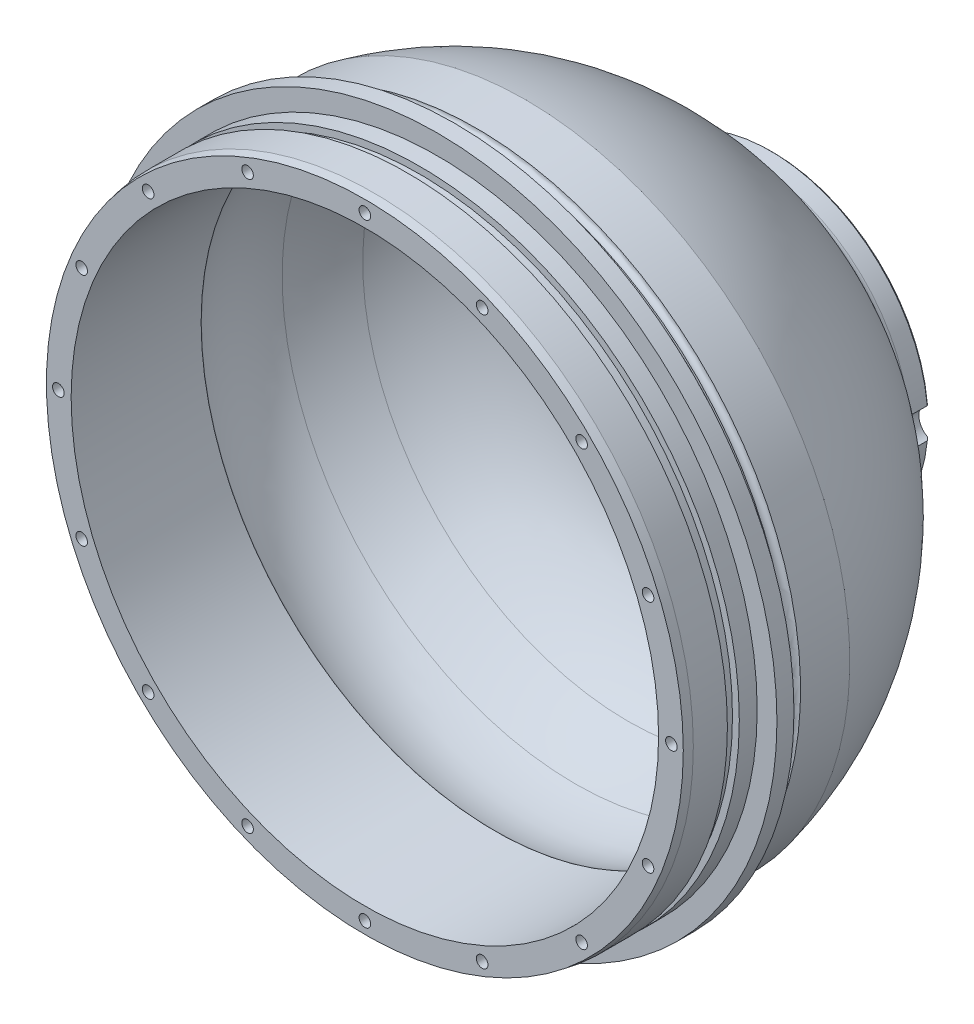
SolidWorks part; units mm, degrees
ref_plane "Front Plane" through (0, 0, 0) normal (0, 0, 1) x (1, 0, 0)
ref_plane "Top Plane" through (0, 0, 0) normal (0, 1, 0) x (1, 0, 0)
ref_plane "Right Plane" through (0, 0, 0) normal (1, 0, 0) x (0, 0, -1)
sketch "Sketch1" plane through (0, 0, 0) normal (1, 0, 0) x (0, 0, -1)
  line L0 (0, 0) -> (0, -87.63) construction
  line L1 (0, -87.63) -> (0, -101.346)
  line L2 (0, -87.63) -> (26.67, -87.63)
  line L3 (0, 0) -> (164.6305, 0) construction
  line L4 (0, -101.346) -> (26.67, -101.346)
  line L5 (26.67, -101.346) -> (26.67, -98.298)
  line L6 (26.67, -98.298) -> (38.7801, -98.298) construction
  line L7 (26.67, -87.63) -> (38.7801, -87.63)
  line L8 (121.7669, 0) -> (121.7669, -46.99)
  line L9 (121.7669, 0) -> (101.4469, 0)
  line L10 (26.67, -87.63) -> (49.53, -91.9045) construction
  line L11 (101.4469, 0) -> (101.4469, -57.9788)
  line L12 (121.7669, -46.99) -> (113.7225, -46.99)
  line L13 (38.7801, -87.63) -> (49.53, -91.9045)
  line L14 (26.67, -98.298) -> (26.67, -96.7105)
  line L15 (26.67, -96.7105) -> (47.9636, -96.7105)
  arc A1 (49.53, -91.9045) -> (101.4469, -57.9788) centre (26.5169, 0) ccw
  arc A2 (47.9636, -96.7105) -> (113.7225, -46.99) centre (26.5169, 0) ccw
  dimension "D6" = 99.06
  dimension "D7" = 94.742
  dimension "D1" = 87.63
  dimension "D2" = 101.346
  dimension "D3" = 26.67
  dimension "D4" = 26.67
  dimension "D5" = 3.048
  dimension "D8" = 46.99
  dimension "D9" = 20.32
  dimension "D10" = 22.86
  dimension "D11" = 12.1101
  dimension "D12" = 95.0969
revolve "hemi" add sketch "Sketch1" angle 360 about L3
sketch "Sketch2" plane through (0, 0, 0) normal (0, 0, 1) x (1, 0, 0)
  circle A0 centre (0, 0) radius 95.4532
  dimension "D1" = 190.9064
extrude "oring_plug" cut sketch "Sketch2" against normal blind 21.59 flip side to cut
ref_plane "oring_plane" through (0, 0, -12.7) normal (0, 0, 1) x (1, 0, 0)
sketch "Sketch3" plane through (0, 0, -12.7) normal (0, 0, 1) x (1, 0, 0)
  circle A0 centre (0, 0) radius 93.4212
  dimension "D1" = 186.8424
extrude "oring_groove" cut sketch "Sketch3" against normal blind 3.556 flip side to cut
chamfer "lead_in_chamfer" distance 2.54 distance2 0.4572 1 edges at (95.4532, 0, 0)
fillet "inside_blkhd_fillet" radius 50.8 1 edges at (57.9788, 0, -101.4469)
fillet "inside_flange_fillet" radius 31.75 1 edges at (91.9045, 0, -49.53)
ref_plane "ortman_plane" through (0, 0, -29.972) normal (0, 0, -1) x (-1, 0, 0)
sketch "Sketch4" plane through (0, 0, -29.972) normal (0, 0, -1) x (-1, 0, 0)
  circle A0 centre (0, 0) radius 95.0595
  dimension "D1" = 190.119
extrude "ortman_groove" cut sketch "Sketch4" along normal blind 3.302 flip side to cut
fillet "ortman_fillet" radius 1.651 2 edges at (-95.0595, 0, -29.972) (-95.0595, 0, -33.274)
sketch "Sketch5" plane through (0, 0, 0) normal (0, 0, 1) x (1, 0, 0)
  circle A0 centre (0, 0) radius 91.44 construction
  circle A1 centre (0, 91.44) radius 1.7272
  circle A2 centre (34.9926, 84.4795) radius 1.7272
  circle A3 centre (64.6578, 64.6578) radius 1.7272
  circle A4 centre (84.4795, 34.9926) radius 1.7272
  circle A5 centre (91.44, 0) radius 1.7272
  circle A6 centre (84.4795, -34.9926) radius 1.7272
  circle A7 centre (64.6578, -64.6578) radius 1.7272
  circle A8 centre (34.9926, -84.4795) radius 1.7272
  circle A9 centre (0, -91.44) radius 1.7272
  circle A10 centre (-34.9926, -84.4795) radius 1.7272
  circle A11 centre (-64.6578, -64.6578) radius 1.7272
  circle A12 centre (-84.4795, -34.9926) radius 1.7272
  circle A13 centre (-91.44, 0) radius 1.7272
  circle A14 centre (-84.4795, 34.9926) radius 1.7272
  circle A15 centre (-64.6578, 64.6578) radius 1.7272
  circle A16 centre (-34.9926, 84.4795) radius 1.7272
  dimension "D1" = 182.88
  dimension "D2" = 3.4544
extrude "male_bolt_circle_holes" cut sketch "Sketch5" against normal blind 7.62
sketch "blkhd_holes" plane through (0, 0, -121.7669) normal (0, 0, -1) x (-1, 0, 0)
  line L0 (0, 0) -> (0, 29.2621) construction
  line L1 (0, 0) -> (29.21, 0) construction
  circle A0 centre (0, 0) radius 4.953
  circle A1 centre (0, 0) radius 10.16 construction
  circle A2 centre (29.21, 16.002) radius 2.7051
  circle A3 centre (29.21, 16.002) radius 7.9375 construction
  circle A4 centre (-29.21, 16.002) radius 7.9375 construction
  circle A5 centre (-29.21, 16.002) radius 2.7051
  circle A6 centre (29.21, -16.002) radius 2.7051
  circle A7 centre (29.21, -16.002) radius 7.9375 construction
  circle A8 centre (-22.86, -5.08) radius 3.4544
  circle A9 centre (-22.86, -5.08) radius 9.525 construction
  circle A10 centre (8.89, -27.94) radius 5.7531
  circle A11 centre (8.89, -27.94) radius 13.335 construction
  circle A12 centre (12.7, 27.94) radius 11.43 construction
  circle A13 centre (12.7, 27.94) radius 5.7531
  circle A14 centre (-17.9617, -27.94) radius 11.43 construction
  dimension "D1" = 9.906
  dimension "D2" = 20.32
  dimension "D3" = 5.4102
  dimension "D6" = 15.875
  dimension "D7" = 6.9088
  dimension "D10" = 19.05
  dimension "D11" = 11.5062
  dimension "D12" = 26.67
  dimension "D15" = 11.5062
  dimension "D17" = 12.7
  dimension "D18" = 22.86
  dimension "D4" = 16.002
  dimension "D5" = 29.21
  dimension "D8" = 5.08
  dimension "D9" = 22.86
  dimension "D13" = 27.94
  dimension "D14" = 8.89
  dimension "D16" = 27.94
fillet "aft_land_fillet" radius 3.175 1 edges at (46.99, 0, -113.7225)
chamfer "Chamfer2" distance 0.762 angle 45 1 edges at (46.99, 0, -121.7669)
extrude "blkhd_thru_holes" cut sketch "blkhd_holes" against normal through all
sketch "Sketch7" plane through (0, 0, -121.7669) normal (0, 0, -1) x (-1, 0, 0)
  circle A0 centre (-10.16, 22) radius 6.35
  dimension "D1" = 12.7
  dimension "D2" = 10.16
  dimension "D3" = 22
sketch "Sketch8" plane through (0, 0, -121.7669) normal (0, 0, -1) x (-1, 0, 0)
  circle A0 centre (12.7, 27.94) radius 11.43
  circle A1 centre (29.21, 16.002) radius 7.9375
  circle A2 centre (29.21, -16.002) radius 7.9375
  circle A3 centre (8.89, -27.94) radius 13.335
  circle A4 centre (-22.86, -5.08) radius 9.525
  circle A5 centre (-29.21, 16.002) radius 7.9375
  circle A6 centre (0, 0) radius 10.16
  dimension "D1" = 22.86
  dimension "D2" = 15.875
  dimension "D3" = 19.05
  dimension "D4" = 26.67
  dimension "D5" = 15.875
  dimension "D6" = 15.875
  dimension "D7" = 20.32
extrude "lands" cut sketch "Sketch8" against normal blind 0.0762
extrude "press_relief_hole" cut sketch "Sketch7" against normal through all
sketch "Sketch9" plane through (0, 0, -121.7669) normal (0, 0, -1) x (-1, 0, 0)
  circle A0 centre (-10.16, 22) radius 9.5504
  dimension "D1" = 19.1008
extrude "press_relief_cbore" cut sketch "Sketch9" against normal blind 5.08
sketch "Sketch10" plane through (0, 0, -101.4469) normal (0, 0, 1) x (1, 0, 0)
  circle A0 centre (0, 0) radius 9.525
  circle A1 centre (22.86, -5.08) radius 9.525
  dimension "D1" = 19.05
  dimension "D2" = 19.05
extrude "Cut-Extrude1" cut sketch "Sketch10" against normal blind 0.254
chamfer "pr_relief_chamfer" distance 0.762 angle 30 1 edges at (0.6096, 22, -121.7669)
chamfer "Chamfer3" distance 0.508 angle 30 1 edges at (16.51, 22, -101.4469)
sketch "Sketch11" plane through (0, 0, -121.7669) normal (0, 0, -1) x (-1, 0, 0)
  line L0 (0, 0) -> (48.26, 0) construction
  line L2 (0, 0) -> (0, -14.8353) construction
  circle A1 centre (48.26, 0) radius 4.7625
  circle A2 centre (-48.26, 0) radius 4.7625
extrude "ANTIROTATION POCKETS" cut sketch "Sketch11" against normal blind 8.89
fillet "Fillet1" radius 0.254 2 edges at (-43.4975, 0, -112.8769) (43.4975, 0, -112.8769)
